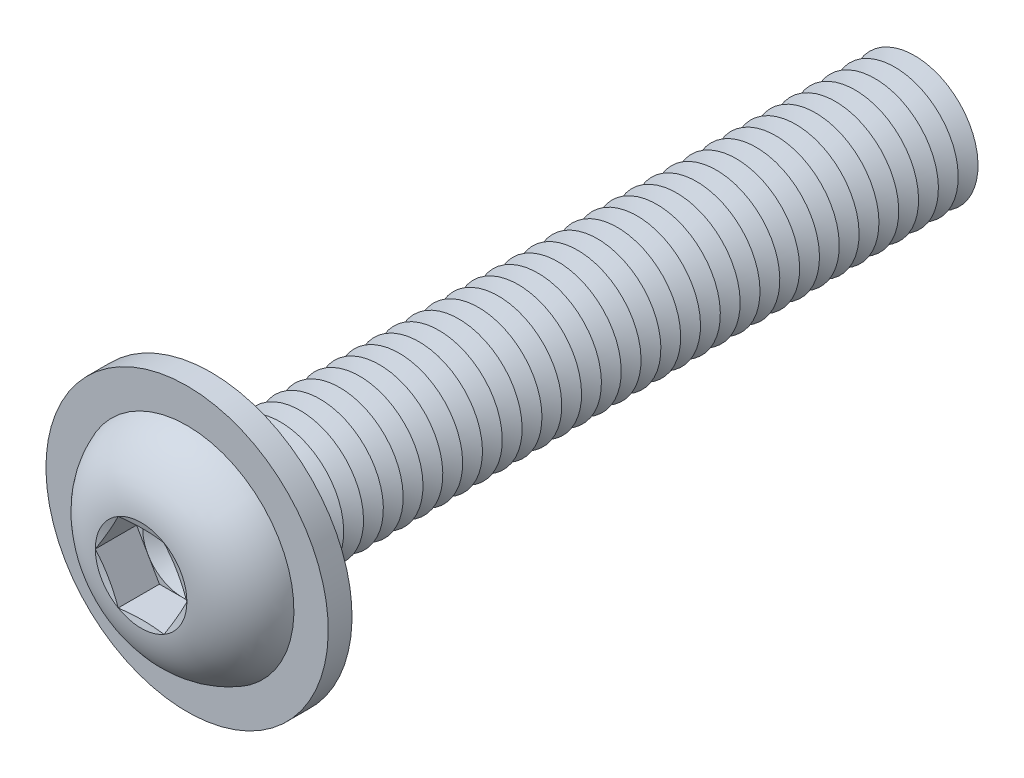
SolidWorks part; units mm, degrees
ref_plane "Front Plane" through (0, 0, 0) normal (0, 0, 1) x (1, 0, 0)
ref_plane "Top Plane" through (0, 0, 0) normal (0, 1, 0) x (1, 0, 0)
ref_plane "Right Plane" through (0, 0, 0) normal (1, 0, 0) x (0, 0, -1)
sketch "Sketch1" plane through (0, 0, 0) normal (1, 0, 0) x (0, 0, -1)
  line L0 (0, 4) -> (0, 7)
  line L3 (0, 4) -> (45, 4)
  line L4 (45, 4) -> (45, 0)
  line L5 (45, 0) -> (-4.4, 0) construction
  line L6 (-4.4, 0) -> (45, 0)
  line L7 (-4.4, 2.8867) -> (-4.4, 1.4434) construction
  line L8 (-4.4, 1.4434) -> (-4.4, 0)
  line L9 (-4.4, 2.8867) -> (-4.0132, 1.4434)
  line L10 (-4.0132, 1.4434) -> (-4.4, 1.4434)
  line L11 (45, 0) -> (22.7481, 0) construction
  line L12 (0, 7) -> (-4.4, 7) construction
  arc A1 (0, 7) -> (-4.4, 2.8867) centre (0, 2.59) ccw
  point P8 (45, 2)
  dimension "D1" = 14
  dimension "D2" = 8
  dimension "D3" = 4.4
  dimension "D4" = 5.7735
  dimension "D5" = 45
  dimension "D6" = 15
revolve "Revolve1" add sketch "Sketch1" angle 360 about L5
fillet "Fillet1" radius 0.625 1 edges at (0, 4, 0)
sketch "Sketch2" plane through (0, 0, 0) normal (1, 0, 0) x (0, 0, -1)
  line L0 (44.375, 4) -> (45.625, 4)
  line L1 (45, 4) -> (0.625, 4) construction
  line L2 (45.625, 4) -> (45, 2.9175)
  line L3 (45, -4) -> (45, 4) construction
  line L4 (45, 2.9175) -> (44.375, 4)
  dimension "D1" = 1.25
revolve "Cut-Revolve1" cut sketch "Sketch2" angle 360 about axis through (0, 0, -45) along (0, 0, -1)
pattern_linear "LPattern1" count 36 spacing 1.25 along (0, 0, 1) of "Cut-Revolve1"
sketch "Sketch3" plane through (0, 0, 4.4) normal (0, 0, 1) x (1, 0, 0)
  line L7 (1.4434, 2.5) -> (-1.4434, 2.5)
  line L8 (-1.4434, 2.5) -> (-2.8867, 0)
  line L9 (-2.8867, 0) -> (-1.4434, -2.5)
  line L10 (-1.4434, -2.5) -> (1.4434, -2.5)
  line L11 (1.4434, -2.5) -> (2.8867, 0)
  line L12 (2.8867, 0) -> (1.4434, 2.5)
  circle A0 centre (0, 0) radius 2.5 construction
  circle A3 centre (0, 0) radius 2.8867 construction
extrude "Cut-Extrude1" cut sketch "Sketch3" against normal blind 2.6
sketch "Sketch4" plane through (0, 0, 1.8) normal (0, 0, 1) x (1, 0, 0)
  line L1 (1.4434, 2.5) -> (-1.4434, 2.5) construction
  circle A0 centre (0, 0) radius 2.5
extrude "Cut-Extrude2" cut sketch "Sketch4" against normal through all draft 60
sketch "Sketch5" plane through (0, 0, 0) normal (0, 0, -1) x (-1, 0, 0)
  circle A0 centre (0, 0) radius 8.9
  circle A1 centre (0, 0) radius 4.625
  circle A2 centre (0, 0) radius 4.625 construction
  dimension "D1" = 17.8
extrude "Boss-Extrude1" add sketch "Sketch5" against normal blind 1.5
